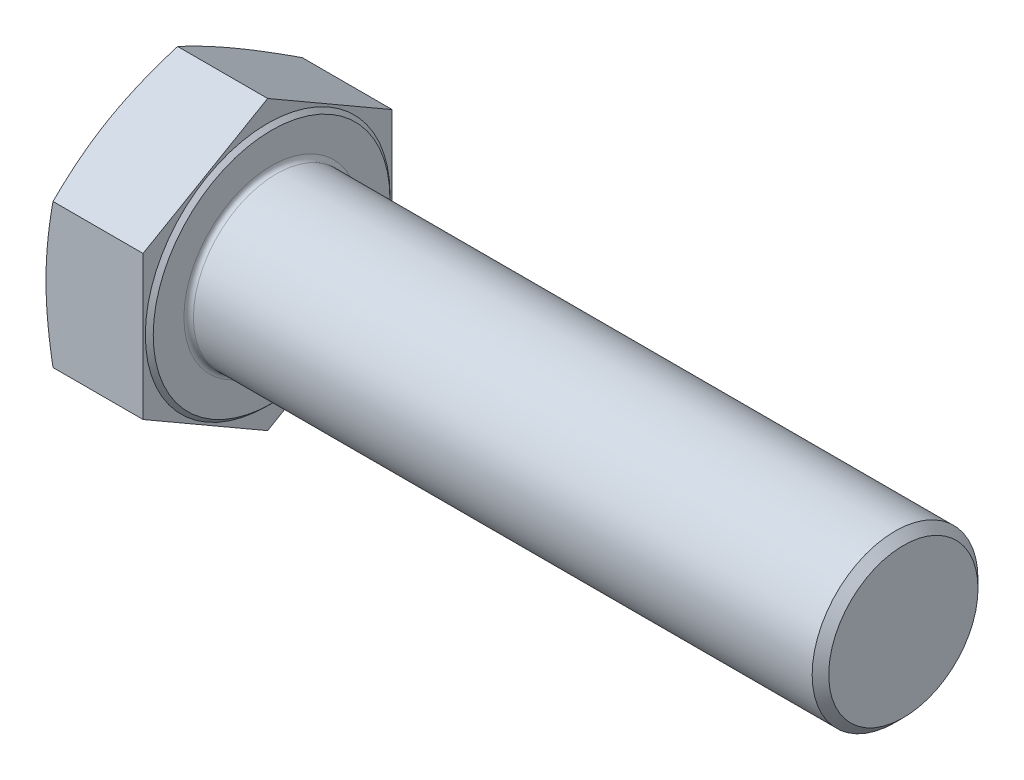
SolidWorks part; units mm, degrees
ref_plane "Front" through (0, 0, 0) normal (0, 0, 1) x (1, 0, 0)
ref_plane "Top" through (0, 0, 0) normal (0, 1, 0) x (1, 0, 0)
ref_plane "Right" through (0, 0, 0) normal (1, 0, 0) x (0, 0, -1)
sketch "Sketch2" plane through (0, 0, 0) normal (1, 0, 0) x (0, 0, -1)
  line L1 (0, -36.4308) -> (31.55, -18.2154)
  line L2 (31.55, -18.2154) -> (31.55, 18.2154)
  line L3 (31.55, 18.2154) -> (0, 36.4308)
  line L4 (0, 36.4308) -> (-31.55, 18.2154)
  line L5 (-31.55, 18.2154) -> (-31.55, -18.2154)
  line L6 (-31.55, -18.2154) -> (0, -36.4308)
  circle A0 centre (0, 0) radius 31.55 construction
  dimension "s" = 63.1
extrude "BaseHead" add sketch "Sketch2" along normal blind 25.58
sketch "Sketch3" plane through (0, 0, 0) normal (0, 0, 1) x (1, 0, 0)
  line L0 (25.58, 36.4308) -> (25.58, 29.975)
  line L2 (25.58, 29.975) -> (24.58, 30.975)
  line L3 (24.58, 30.975) -> (24.58, 36.4308)
  line L5 (24.58, 36.4308) -> (25.58, 36.4308)
  line L6 (-0.9571, 0) -> (7.6478, 0) construction
  line L7 (25.58, 36.4308) -> (0, 36.4308) construction
  dimension "D1" = 45
  dimension "c" = 1
  dimension "dw" = 59.95
revolve "BearingFace" cut sketch "Sketch3" angle 360 about L6
sketch "Sketch4" plane through (0, 0, 0) normal (0, 0, 1) x (1, 0, 0)
  line L0 (-0.4935, 0) -> (3.5626, 0) construction
  line L2 (0, 36.4308) -> (1.7765, 36.4308)
  line L4 (1.7765, 36.4308) -> (0, 31.55)
  line L6 (0, 31.55) -> (0, 36.4308)
  line L7 (24.58, 36.4308) -> (0, 36.4308) construction
  dimension "D1" = 20
  dimension "D2" = 63.1
revolve "HeadChamfer" cut sketch "Sketch4" angle 360 about L0
ref_plane "Plane1" through (89.58, 0, 0) normal (1, 0, 0) x (0, 0, -1)
sketch "Sketch5" plane through (25.58, 0, 0) normal (1, 0, 0) x (0, 0, -1)
  circle A0 centre (0, 0) radius 21
  dimension "d" = 42
extrude "BaseBody" add sketch "Sketch5" along normal blind 160
chamfer "Chamfer1" distance 2.1 angle 45 1 edges at (185.58, 0, -21)
fillet "HeadFillet" radius 1.2 1 edges at (25.58, 0, 21)
equation "\"D2@Sketch4\" = \"s@Sketch2\""
equation "\"b@ThreadCosmetic1\" = \"l@BaseBody\" - \"lg@Plane1\""
equation "\"D1@Chamfer1\" = 0.05 * \"d@Sketch5\""
